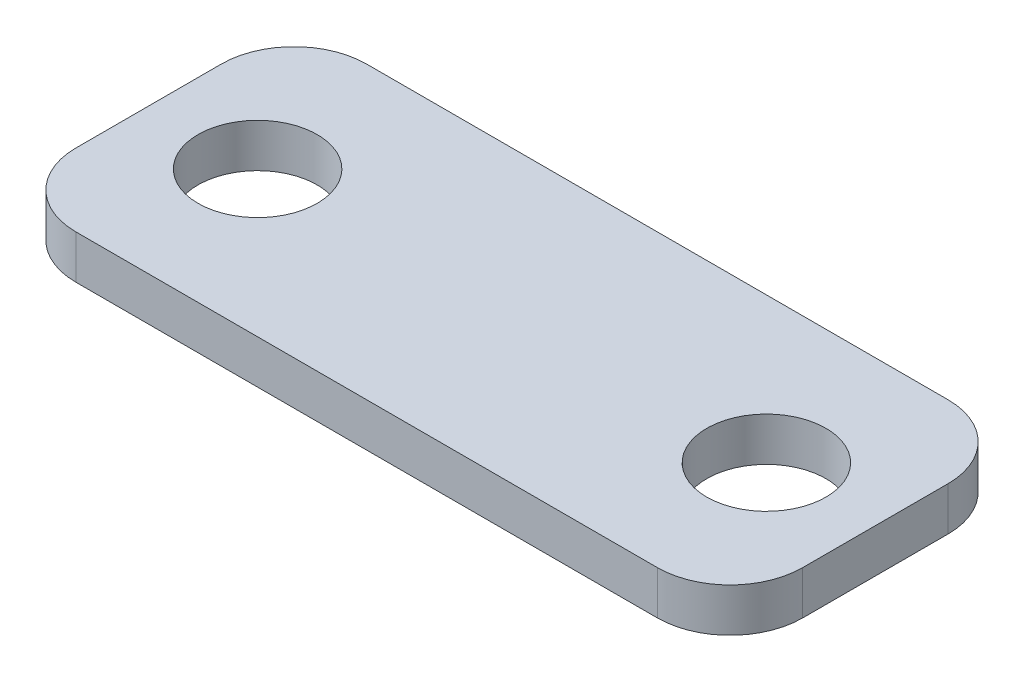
SolidWorks part; units mm, degrees
ref_plane "Front Plane" through (0, 0, 0) normal (0, 0, 1) x (1, 0, 0)
ref_plane "Top Plane" through (0, 0, 0) normal (0, 1, 0) x (1, 0, 0)
ref_plane "Right Plane" through (0, 0, 0) normal (1, 0, 0) x (0, 0, -1)
sketch "Sketch1" plane through (0, 0, 0) normal (0, 1, 0) x (1, 0, 0)
  line L1 (-25, -10) -> (25, -10)
  line L2 (-25, -10) -> (-25, 10)
  line L3 (-25, 10) -> (25, 10)
  line L4 (25, -10) -> (25, 10)
  line L5 (-25, -10) -> (25, 10) construction
  line L6 (-25, 10) -> (25, -10) construction
  point P0 (0, 0)
  dimension "D1" = 50
  dimension "D2" = 20
extrude "Boss-Extrude1" add sketch "Sketch1" along normal blind 3
sketch "Sketch2" plane through (0, 3, 0) normal (0, 1, 0) x (1, 0, 0)
  line L2 (25, 10) -> (-25, 10) construction
  circle A0 centre (-17.5, 0) radius 4.1
  circle A1 centre (17.5, 0) radius 4.1
  dimension "D1" = 8.2
  dimension "D2" = 8.2
  dimension "D4" = 35
  dimension "D5" = 17.5
  dimension "D3" = 10
  dimension "D6" = 10
extrude "Cut-Extrude1" cut sketch "Sketch2" against normal blind 3
fillet "Fillet1" radius 5 4 edges at (25, 1.5, -10) (25, 1.5, 10) (-25, 1.5, 10) (-25, 1.5, -10)
